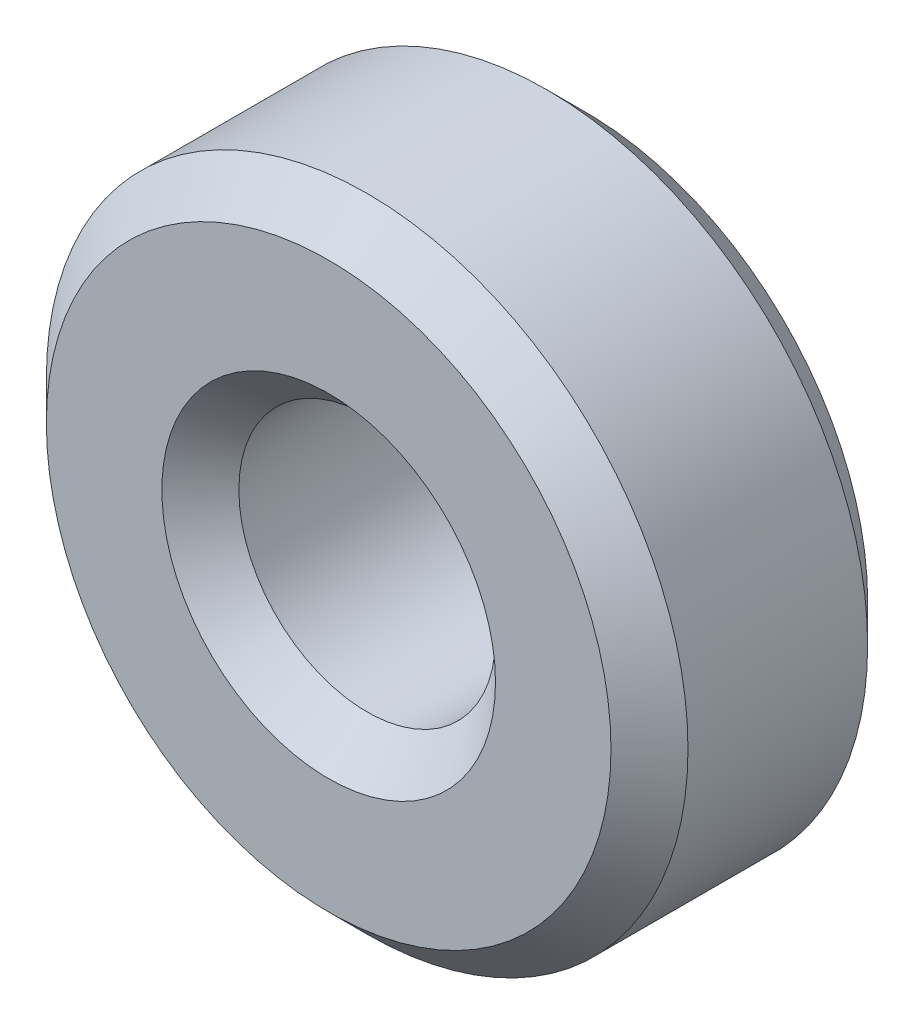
SolidWorks part; units mm, degrees
ref_plane "Plan1" through (0, 0, 0) normal (0, 0, 1) x (1, 0, 0)
ref_plane "Plan2" through (0, 0, 0) normal (0, 1, 0) x (1, 0, 0)
ref_plane "Plan3" through (0, 0, 0) normal (1, 0, 0) x (0, 0, -1)
sketch "Esquisse1" plane through (0, 0, 0) normal (0, 0, 1) x (1, 0, 0)
  circle A0 centre (0, 0) radius 1
  circle A1 centre (0, 0) radius 2.5
  dimension "D1" = 2
  dimension "D2" = 5
extrude "Base-Extrusion" add sketch "Esquisse1" along normal blind 2
chamfer "Chanfrein1" distance 0.3 angle 45 4 edges at (2.5, 0, 0) (2.5, 0, 2) (1, 0, 0) (1, 0, 2)
